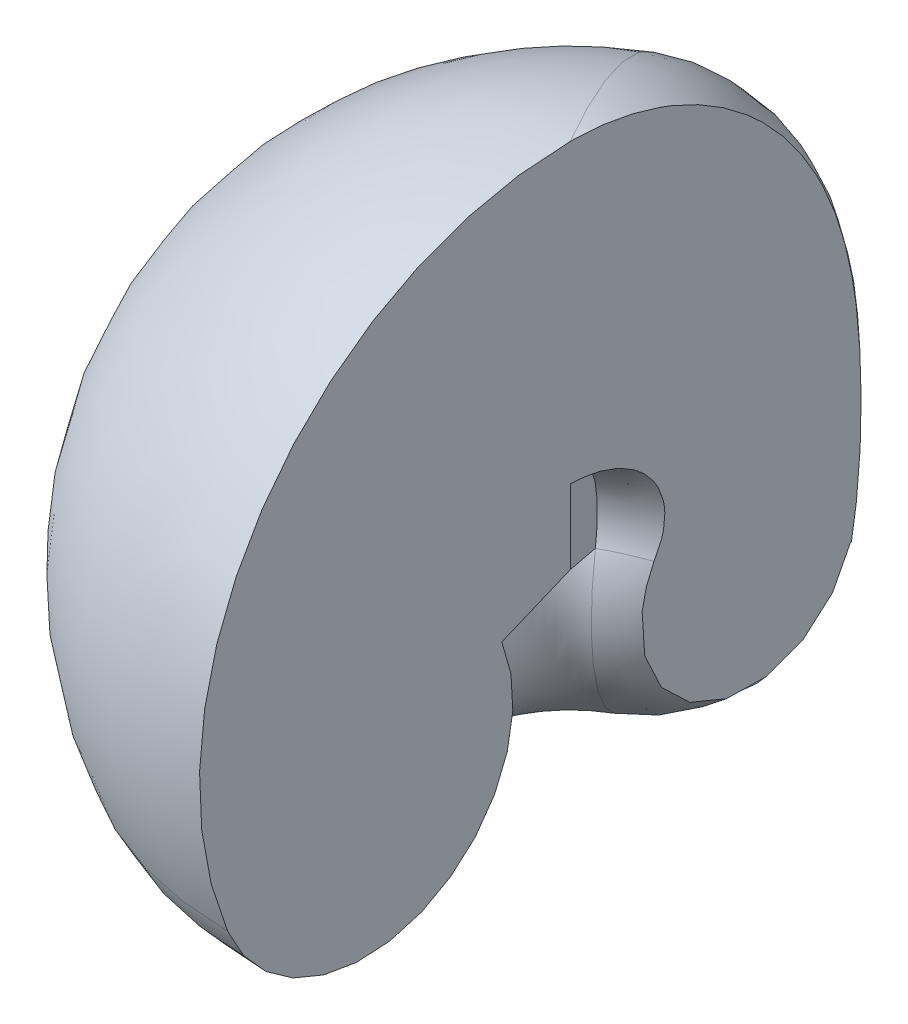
SolidWorks part; units mm, degrees
ref_plane "Plane1" through (0, 0, 0) normal (0, 0, 1) x (1, 0, 0)
ref_plane "Plane2" through (0, 0, 0) normal (0, 1, 0) x (1, 0, 0)
ref_plane "Plane3" through (0, 0, 0) normal (1, 0, 0) x (0, 0, -1)
mirrored part "B1312-"
other "<B1312>-<Cut-Extrude2>"
